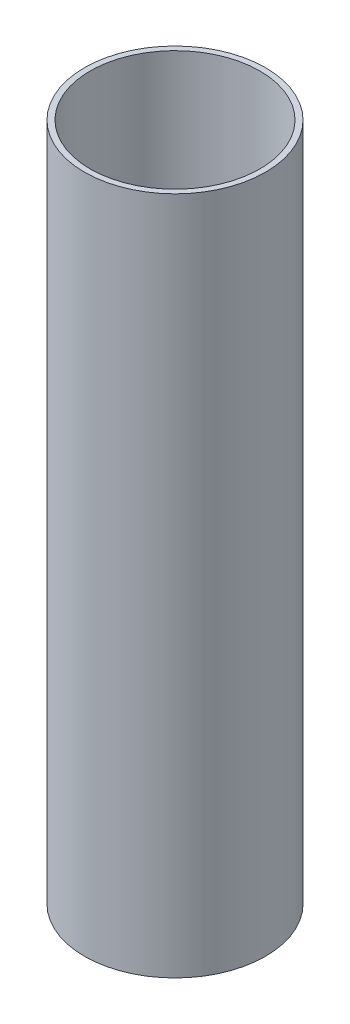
SolidWorks part; units mm, degrees
ref_plane "Front Plane" through (0, 0, 0) normal (0, 0, 1) x (1, 0, 0)
ref_plane "Top Plane" through (0, 0, 0) normal (0, 1, 0) x (1, 0, 0)
ref_plane "Right Plane" through (0, 0, 0) normal (1, 0, 0) x (0, 0, -1)
sketch "Sketch1" plane through (0, 0, 0) normal (0, 1, 0) x (1, 0, 0)
  circle A0 centre (0, 0) radius 50.8
  circle A1 centre (0, 0) radius 47.625
  dimension "D1" = 101.6
  dimension "D2" = 95.25
extrude "Boss-Extrude1" add sketch "Sketch1" along normal blind 381
